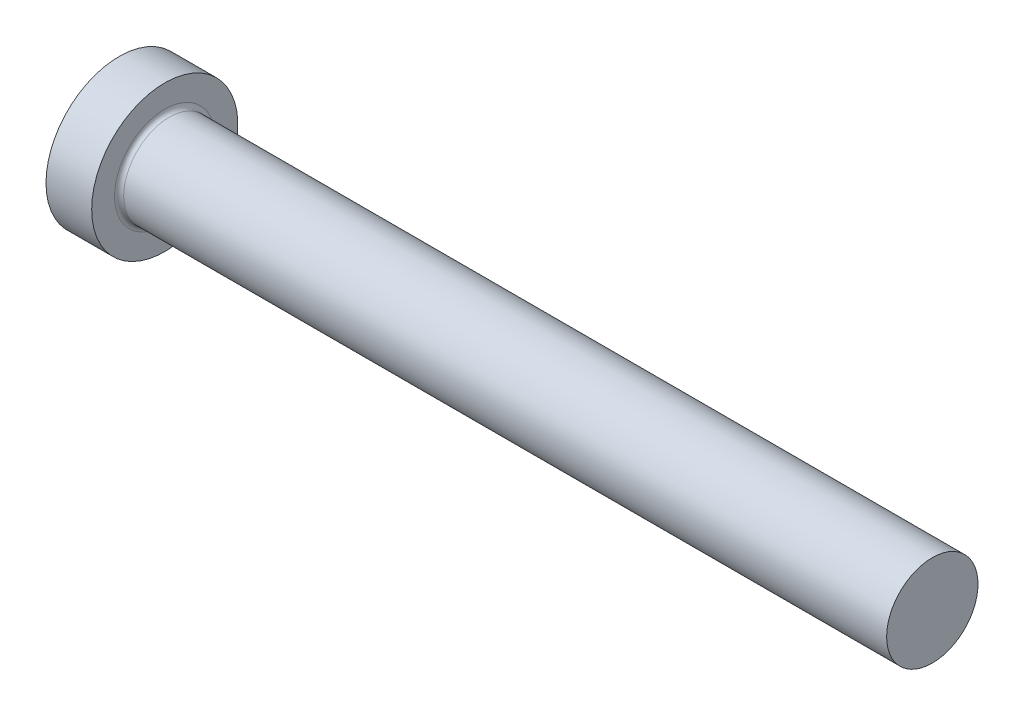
SolidWorks part; units mm, degrees
ref_plane "Face" through (0, 0, 0) normal (0, 0, 1) x (1, 0, 0)
ref_plane "Dessus" through (0, 0, 0) normal (0, 1, 0) x (1, 0, 0)
ref_plane "Droite" through (0, 0, 0) normal (1, 0, 0) x (0, 0, -1)
imported_body "Importée1"
sketch "Esquisse1" plane through (100, 0, 0) normal (1, 0, 0) x (0, 0, -1)
  circle A1 centre (0, 0) radius 5
  circle A2 centre (0, 0) radius 5
  dimension "D1" = 0
extrude "Enlèv. mat.-Extru.1" cut sketch "Esquisse1" against normal blind 11
